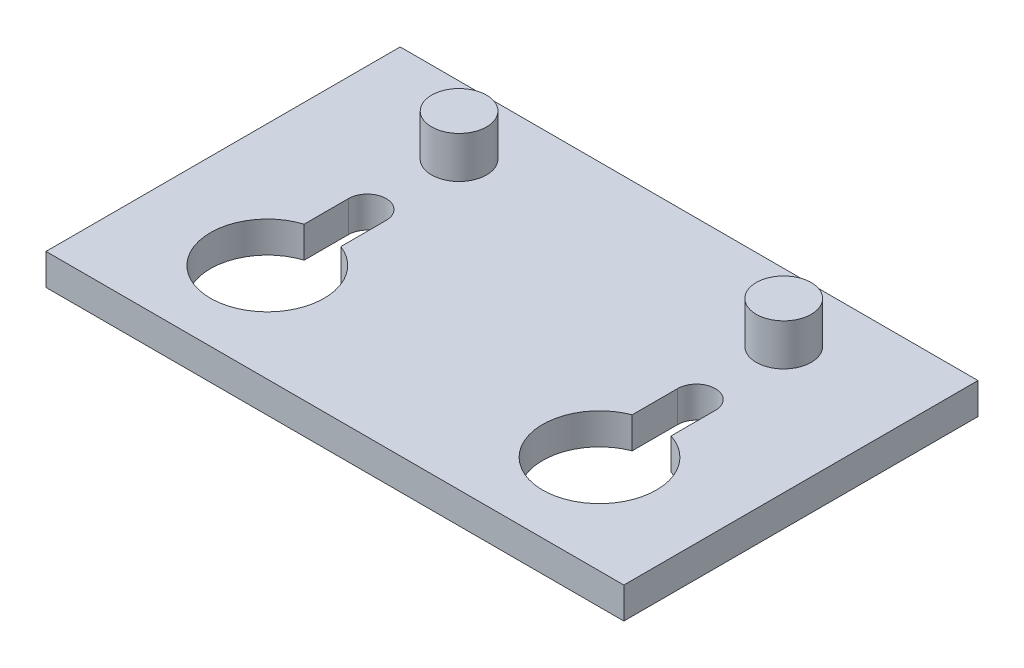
SolidWorks part; units mm, degrees
ref_plane "Front Plane" through (0, 0, 0) normal (0, 0, 1) x (1, 0, 0)
ref_plane "Top Plane" through (0, 0, 0) normal (0, 1, 0) x (1, 0, 0)
ref_plane "Right Plane" through (0, 0, 0) normal (1, 0, 0) x (0, 0, -1)
sketch "Sketch1" plane through (0, 0, 0) normal (0, 1, 0) x (1, 0, 0)
  line L0 (-70.4702, -43.1914) -> (70.4702, 43.1914) construction
  line L1 (-70.4702, 43.1914) -> (70.4702, 43.1914)
  line L2 (-70.4702, 43.1914) -> (-70.4702, -43.1914)
  line L3 (-70.4702, -43.1914) -> (70.4702, -43.1914)
  line L4 (70.4702, 43.1914) -> (70.4702, -43.1914)
extrude "Extrude1" add sketch "Sketch1" along normal blind 7.62
sketch "Sketch2" plane through (0, 7.62, 0) normal (0, 1, 0) x (-1, 0, 0)
  line L0 (35.5336, -4.8577) -> (35.5336, 6.2156)
  line L1 (44.7435, -4.8577) -> (44.7435, 5.952)
  arc A0 (44.7435, 5.952) -> (35.5336, 6.2156) centre (40.5131, 19.1668) ccw
  arc A1 (35.5336, -4.8577) -> (44.7435, -4.8577) centre (40.1386, -4.8577) ccw
extrude "Cut-Extrude1" cut sketch "Sketch2" against normal through all
sketch "Sketch3" plane through (0, 7.62, 0) normal (0, 1, 0) x (-1, 0, 0)
  circle A0 centre (39.5901, -26.6841) radius 6.7095
extrude "Extrude2" add sketch "Sketch3" along normal blind 10.16
mirror "Mirror2" about plane through (0, 0, 0) normal (1, 0, 0) of "Extrude2", "Cut-Extrude1"
